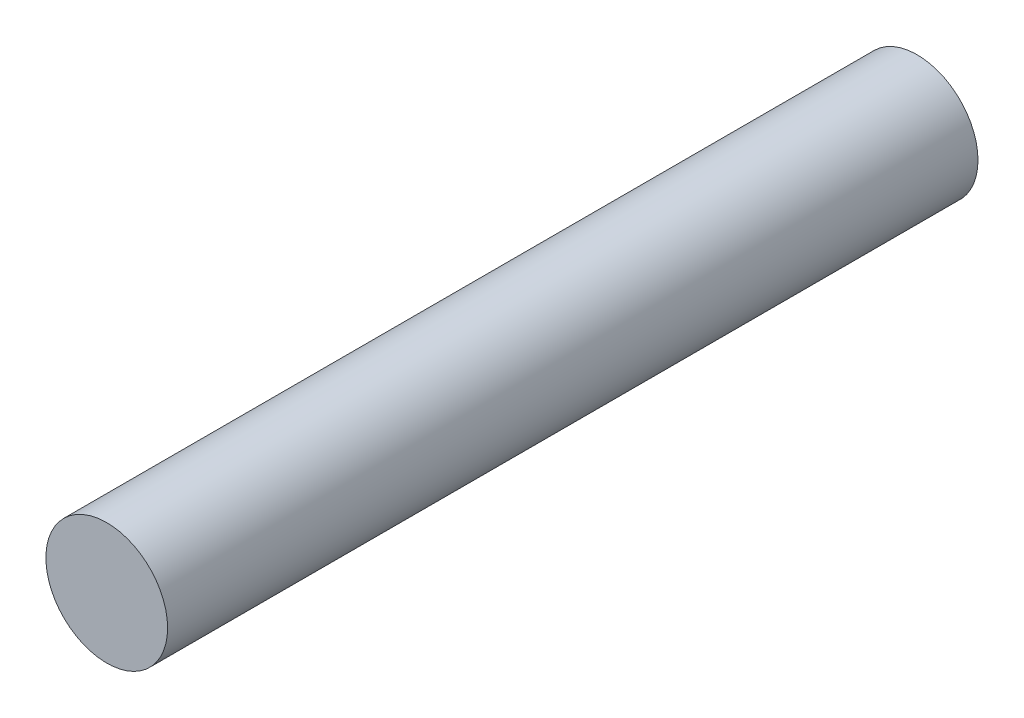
SolidWorks part; units mm, degrees
ref_plane "Front Plane" through (0, 0, 0) normal (0, 0, 1) x (1, 0, 0)
ref_plane "Top Plane" through (0, 0, 0) normal (0, 1, 0) x (1, 0, 0)
ref_plane "Right Plane" through (0, 0, 0) normal (1, 0, 0) x (0, 0, -1)
sketch "Sketch1" plane through (0, 0, 0) normal (0, 0, 1) x (1, 0, 0)
  circle A0 centre (0, 0) radius 38
  dimension "D1" = 76
extrude "Boss-Extrude1" add sketch "Sketch1" along normal mid plane 506
